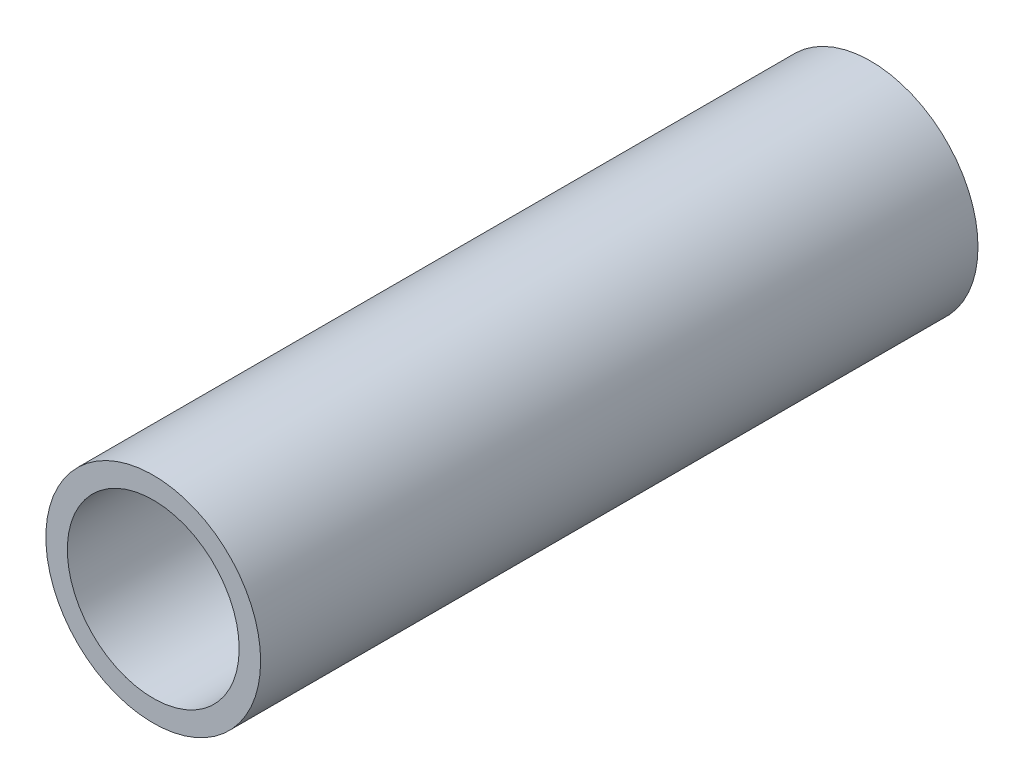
SolidWorks part; units mm, degrees
ref_plane "Front Plane" through (0, 0, 0) normal (0, 0, 1) x (1, 0, 0)
ref_plane "Top Plane" through (0, 0, 0) normal (0, 1, 0) x (1, 0, 0)
ref_plane "Right Plane" through (0, 0, 0) normal (1, 0, 0) x (0, 0, -1)
sketch "Sketch1" plane through (0, 0, 0) normal (0, 0, 1) x (1, 0, 0)
  circle A0 centre (0, 0) radius 25
  dimension "D1" = 50
extrude "Extrude-Thin1" add sketch "Sketch1" along normal mid plane 167 thin
